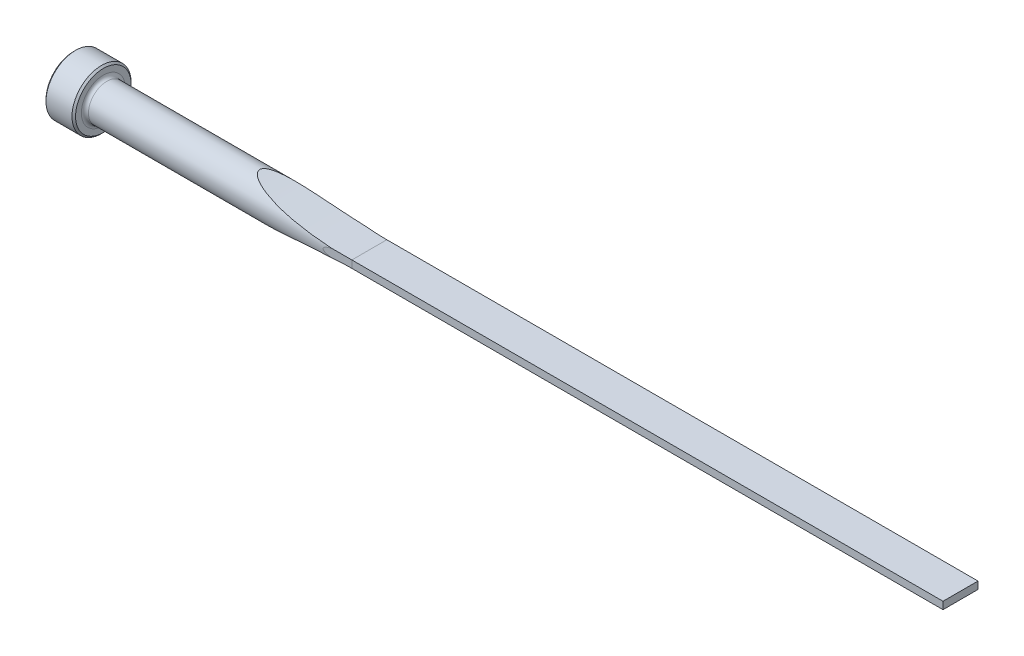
SolidWorks part; units mm, degrees
ref_plane "Front Plane" through (0, 0, 0) normal (0, 0, 1) x (1, 0, 0)
ref_plane "Top Plane" through (0, 0, 0) normal (0, 1, 0) x (1, 0, 0)
ref_plane "Right Plane" through (0, 0, 0) normal (1, 0, 0) x (0, 0, -1)
sketch "Sketch1" plane through (0, 0, 0) normal (0, 0, 1) x (1, 0, 0)
  line L0 (0, 0) -> (175.5286, 0) construction
  line L1 (0, 0) -> (0, 6.35)
  line L2 (0, 6.35) -> (6.35, 6.35)
  line L3 (6.35, 6.35) -> (6.35, 3.9624)
  line L4 (6.35, 3.9624) -> (190.5, 3.9624)
  line L5 (190.5, 3.9624) -> (190.5, 0)
  line L6 (190.5, 0) -> (0, 0)
  dimension "D1" = 190.5
  dimension "D2" = 12.7
  dimension "D3" = 7.9248
  dimension "D4" = 6.35
revolve "Revolve1" add sketch "Sketch1" angle 360 about L0
sketch "Sketch2" plane through (0, 0, 0) normal (0, 0, 1) x (1, 0, 0)
  line L0 (190.5, 3.9624) -> (190.5, 0.7874)
  line L1 (190.5, -3.9624) -> (190.5, 3.9624) construction
  line L2 (190.5, 0.7874) -> (63.5, 0.7874)
  line L3 (190.5, 3.9624) -> (6.35, 3.9624) construction
  line L4 (39.9536, 3.9624) -> (190.5, 3.9624)
  line L5 (166.0833, 0) -> (153.1705, 0) construction
  arc A0 (63.5, 0.7874) -> (39.9536, 3.9624) centre (63.5, 89.6874) cw
  dimension "D1" = 88.9
  dimension "D3" = 127
  dimension "D2" = 1.5748
  dimension "D4" = 23.5464
extrude "Cut-Extrude1" cut sketch "Sketch2" against normal through all both and the other way through all
mirror "Mirror1" about plane through (0, 0, 0) normal (0, 1, 0) of "Cut-Extrude1"
sketch "Sketch3" plane through (0, 0, 0) normal (0, 1, 0) x (1, 0, 0)
  line L0 (190.5, 3.9624) -> (190.5, 3.7592)
  line L1 (190.5, 3.8834) -> (190.5, -3.8834) construction
  line L2 (190.5, 3.7592) -> (63.5, 3.7592)
  line L3 (190.5, 3.9624) -> (6.35, 3.9624) construction
  line L4 (57.4927, 3.9624) -> (190.5, 3.9624)
  line L5 (163.4716, 0) -> (166.2513, 0) construction
  line L6 (63.5, 3.8834) -> (63.5, -3.8834) construction
  arc A0 (63.5, 3.7592) -> (57.4927, 3.9624) centre (63.5, 92.6592) cw
  dimension "D2" = 88.9
  dimension "D1" = 7.5184
extrude "Cut-Extrude2" cut sketch "Sketch3" against normal through all both and the other way through all
mirror "Mirror2" about plane through (0, 0, 0) normal (0, 0, 1) of "Cut-Extrude2"
fillet "Fillet1" radius 0.762 1 edges at (6.35, 0, 3.9624)
chamfer "Chamfer1" distance 0.381 angle 45 2 edges at (0, 0, 6.35) (6.35, 0, 6.35)
